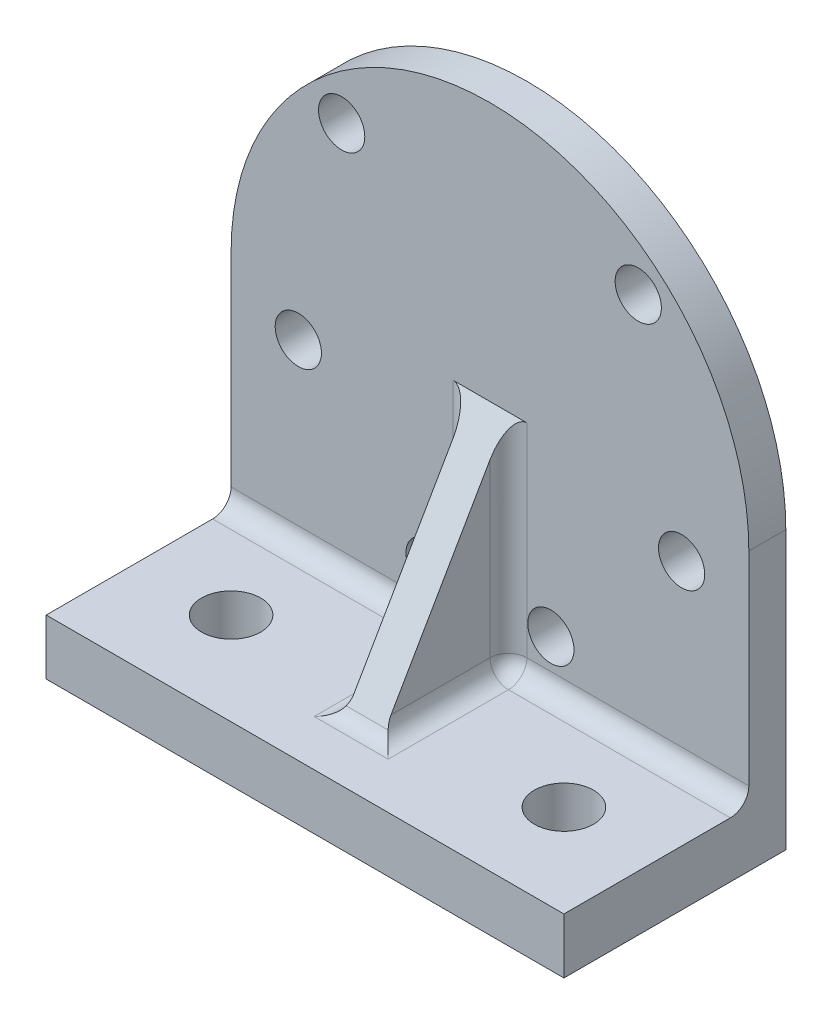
SolidWorks part; units mm, degrees
ref_plane "前视基准面" through (0, 0, 0) normal (0, 0, 1) x (1, 0, 0)
ref_plane "上视基准面" through (0, 0, 0) normal (0, 1, 0) x (1, 0, 0)
ref_plane "右视基准面" through (0, 0, 0) normal (1, 0, 0) x (0, 0, -1)
sketch "草图1" plane through (0, 0, 0) normal (0, 0, 1) x (1, 0, 0)
  line L1 (-14, 13) -> (14, 13)
  line L2 (-14, 13) -> (-14, -13)
  line L3 (-14, -13) -> (14, -13)
  line L4 (14, 13) -> (14, -13)
  line L5 (-14, 13) -> (14, -13) construction
  line L6 (-14, -13) -> (14, 13) construction
  point P0 (0, 0)
  dimension "D1" = 28
  dimension "D2" = 26
extrude "凸台-拉伸1" add sketch "草图1" along normal blind 2
sketch "草图3" plane through (0, 0, 2) normal (0, 0, 1) x (1, 0, 0)
  line L0 (-14, -1) -> (-14, 13)
  line L1 (-14, 13) -> (0, 13)
  line L2 (0, 13) -> (14, 13)
  line L3 (14, 13) -> (14, -1)
  arc A0 (14, -1) -> (-14, -1) centre (0, -1) ccw
extrude "切除-拉伸2" cut sketch "草图3" against normal blind 2 contours A0 M5 M6 | A0 M4 M5
sketch "草图4" plane through (0, -13, 0) normal (0, -1, 0) x (1, 0, 0)
  line L1 (-14, 0) -> (14, 0)
  line L2 (-14, 0) -> (-14, 12)
  line L3 (-14, 12) -> (14, 12)
  line L4 (14, 0) -> (14, 12)
  dimension "D1" = 12
  dimension "D2" = 28
extrude "凸台-拉伸2" add sketch "草图4" along normal blind 3
fillet "圆角1" radius 1 1 edges at (0, -13, 2)
sketch "草图5" plane through (0, -13, 0) normal (0, 1, 0) x (1, 0, 0)
  line L0 (14, -3) -> (14, -12) construction
  line L1 (14, -12) -> (-14, -12) construction
  line L2 (-14, -12) -> (-14, -3) construction
  circle A0 centre (-9, -7) radius 1.6
  circle A1 centre (9, -7) radius 1.6
  dimension "D1" = 3.2
  dimension "D2" = 3.2
  dimension "D3" = 5
  dimension "D4" = 5
  dimension "D5" = 5
  dimension "D6" = 5
extrude "切除-拉伸3" cut sketch "草图5" against normal blind 3
sketch "草图6" plane through (0, 0, 0) normal (0, 0, -1) x (-1, 0, 0)
  line L0 (0, -19.2382) -> (0, 20.8544) construction
  circle A0 centre (8.0201, 8.0201) radius 1.25 construction
  circle A1 centre (3.2936, -10.3647) radius 1.25
  circle A2 centre (10.3647, -3.2936) radius 1.25
  circle A3 centre (-10.3647, -3.2936) radius 1.25 construction
  circle A4 centre (-3.2936, -10.3647) radius 1.25 construction
  circle A5 centre (8.0201, 8.0201) radius 1.25
  circle A6 centre (-10.3647, -3.2936) radius 1.25
  circle A7 centre (-3.2936, -10.3647) radius 1.25
  circle A8 centre (-8.0201, 8.0201) radius 1.25
extrude "切除-拉伸4" cut sketch "草图6" against normal blind 10
ref_plane "基准面1" through (0, 0, 0) normal (-1, 0, 0) x (0, 0, 1)
sketch "草图7" plane through (0, 0, -14) normal (1, 0, 0) x (0, 0, -1)
  line L0 (-22.9282, -13) -> (-16, -1)
  line L1 (-17, -13) -> (-26, -13) construction
  line L2 (-16, -12) -> (-16, -1) construction
  dimension "D1" = 30
  dimension "D2" = 12
rib "筋3" sketch "草图7" sketch "草图7" thickness 2 extrusion direction parallel to sketch draft on no parameters "D1"=2
fillet "圆角2" radius 1 7 edges at (1, -13, 5.9641) (1, -12.7071, 2.2929) (-1, -13, 5.9641) (-1, -12.7071, 2.2929) (1, -6.5, 2) (-1, -6.5, 2) (0, -13, 8.9282)
